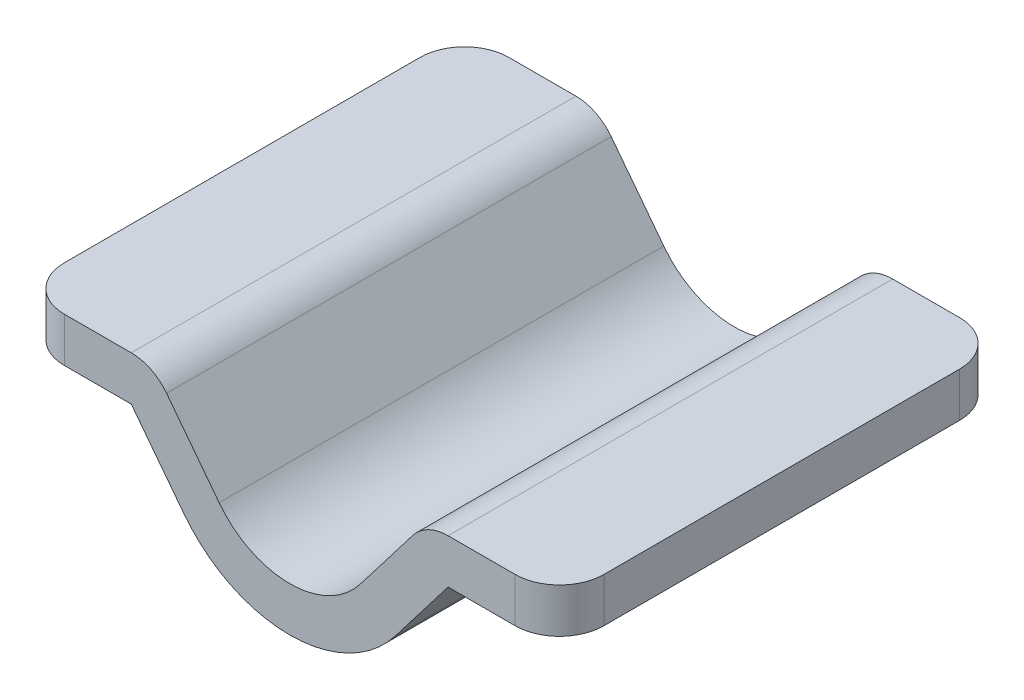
SolidWorks part; units mm, degrees
ref_plane "Front Plane" through (0, 0, 0) normal (0, 0, 1) x (1, 0, 0)
ref_plane "Top Plane" through (0, 0, 0) normal (0, 1, 0) x (1, 0, 0)
ref_plane "Right Plane" through (0, 0, 0) normal (1, 0, 0) x (0, 0, -1)
sketch "Sketch1" plane through (0, 0, 0) normal (0, 0, 1) x (1, 0, 0)
  line L0 (-40.3023, 52.523) -> (-70.3351, 91.6625)
  line L1 (-90.4863, 101.6) -> (-154.1604, 101.6)
  line L2 (0, 0) -> (0, 148.9556) construction
  line L3 (90.4863, 101.6) -> (154.1604, 101.6)
  line L4 (40.3023, 52.523) -> (70.3351, 91.6625)
  arc A0 (-40.3023, 52.523) -> (40.3023, 52.523) centre (0, 83.4481) ccw
  arc A1 (-70.3351, 91.6625) -> (-90.4863, 101.6) centre (-90.4863, 76.2) ccw
  arc A2 (90.4863, 101.6) -> (70.3351, 91.6625) centre (90.4863, 76.2) ccw
  point P12 (-77.9604, 101.6)
  point P15 (77.9604, 101.6)
  dimension "D4" = 50.8
  dimension "D5" = 25.4
  dimension "D1" = 76.2
  dimension "D2" = 101.6
  dimension "D3" = 75
extrude "Extrude-Thin1" add sketch "Sketch1" along normal mid plane 254 thin
fillet "Fillet1" radius 25.4 4 edges at (154.1604, 88.9, 127) (154.1604, 88.9, -127) (-154.1604, 88.9, -127) (-154.1604, 88.9, 127)
